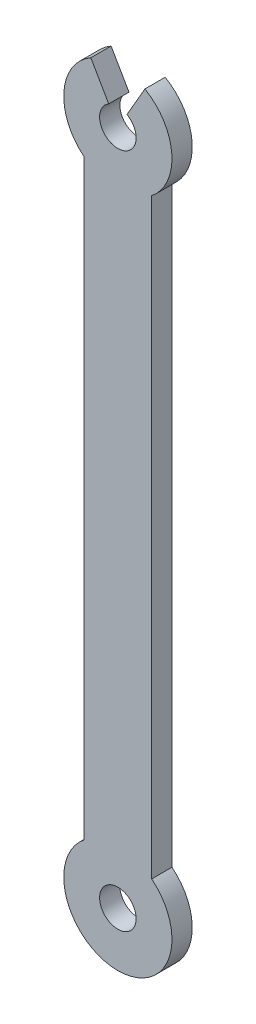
SolidWorks part; units mm, degrees
ref_plane "前视基准面" through (0, 0, 0) normal (0, 0, 1) x (1, 0, 0)
ref_plane "上视基准面" through (0, 0, 0) normal (0, 1, 0) x (1, 0, 0)
ref_plane "右视基准面" through (0, 0, 0) normal (1, 0, 0) x (0, 0, -1)
other "Configuration Table"
sketch "草图1" plane through (0, 0, 0) normal (0, 0, 1) x (1, 0, 0)
  line L0 (0, 0) -> (2.5, 0) construction
  line L1 (0, 0) -> (-2.5, 0) construction
  line L2 (0, 0) -> (0, -50) construction
  line L3 (0, -50) -> (2.5, -50) construction
  line L4 (0, -50) -> (-2.5, -50) construction
  line L5 (-2.5, -46.8775) -> (-2.5, -3.1225)
  line L6 (2.5, -3.1225) -> (2.5, -46.8775)
  line L7 (-2.5, 0) -> (-2.5, -3.1225) construction
  line L8 (2.5, 0) -> (2.5, -3.1225) construction
  line L9 (-2.5, -46.8775) -> (-2.5, -50) construction
  line L10 (2.5, -46.8775) -> (2.5, -50) construction
  line L11 (-0.675, 1.1691) -> (-2, 3.4641)
  line L12 (0.675, 1.1691) -> (2, 3.4641)
  line L13 (-0.675, 1.1691) -> (0, 0) construction
  line L14 (0, 0) -> (0.675, 1.1691) construction
  circle A0 centre (0, 0) radius 1.35
  arc A1 (2.5, -3.1225) -> (2, 3.4641) centre (0, 0) ccw
  circle A2 centre (0, -50) radius 1.35
  arc A3 (-2.5, -46.8775) -> (2.5, -46.8775) centre (0, -50) ccw
  arc A4 (-2, 3.4641) -> (-2.5, -3.1225) centre (0, 0) ccw
  dimension "D1" = 2.7
  dimension "D2" = 8
  dimension "D5" = 2.7
  dimension "D7" = 8
  dimension "D3" = 2.5
  dimension "D4" = 2.5
  dimension "D6" = 50
  dimension "D8" = 2.5
  dimension "D9" = 2.5
  dimension "D10" = 150
  dimension "D11" = 150
  dimension "D12" = 150
extrude "凸台-拉伸1" add sketch "草图1" along normal blind 1.5 contours L11 A4 L5 A3 L6 A1 L12 A0 A2
equation "\"1。5\"=10"
